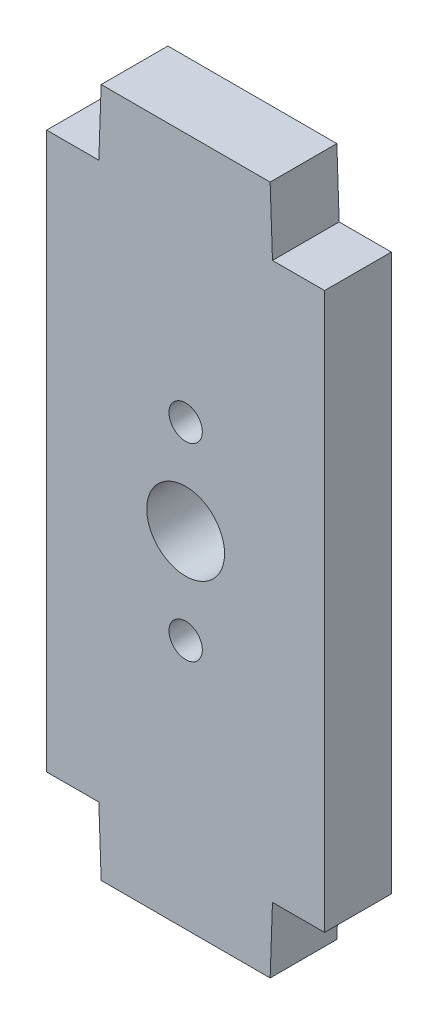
SolidWorks part; units mm, degrees
ref_plane "Front" through (0, 0, 0) normal (0, 0, 1) x (1, 0, 0)
ref_plane "Top" through (0, 0, 0) normal (0, 1, 0) x (1, 0, 0)
ref_plane "Right" through (0, 0, 0) normal (1, 0, 0) x (0, 0, -1)
sketch "Sketch1" plane through (0, 0, 0) normal (0, 0, 1) x (1, 0, 0)
  line L0 (12.5, 25) -> (-12.5, -25) construction
  line L1 (-12.5, -25) -> (12.5, -25)
  line L2 (-12.5, -25) -> (-12.5, 25)
  line L3 (-12.5, 25) -> (12.5, 25)
  line L4 (12.5, -25) -> (12.5, 25)
  dimension "D1" = 25
  dimension "D2" = 50
extrude "Boss-Extrude1" add sketch "Sketch1" along normal blind 6
sketch "Sketch2" plane through (0, 0, 6) normal (0, 0, 1) x (1, 0, 0)
  line L0 (-6.6136, 0) -> (6.6136, 0) construction
  circle A0 centre (0, 0) radius 3.5
  circle A1 centre (0, -8.5) radius 1.5
  circle A2 centre (0, 8.5) radius 1.5
  circle A4 centre (0, 0) radius 12.5 construction
  dimension "D2" = 3
  dimension "D3" = 7
  dimension "D4" = 25
  dimension "D1" = 17
extrude "motor hole pattern" cut sketch "Sketch2" against normal through all
sketch "Sketch3" plane through (0, 0, 6) normal (0, 0, 1) x (1, 0, 0)
  line L0 (-12.5, -25) -> (12.5, -25) construction
  line L1 (12.5, 25) -> (-12.5, 25) construction
  point P0 (-3.2061, 46.6368)
  line B0 (7.8095, -25) -> (-7.8095, -25)
  line B1 (-7.8095, -25) -> (-7.6, -31)
  line B2 (-7.6, -31) -> (7.6, -31)
  line B3 (7.8095, -25) -> (7.6, -31)
  line B4 (-7.8095, 25) -> (7.8095, 25)
  line B5 (7.8095, 25) -> (7.6, 31)
  line B6 (7.6, 31) -> (-7.6, 31)
  line B7 (-7.8095, 25) -> (-7.6, 31)
sketch_block_instance "Block-laser-cut-tab-15x6-1"
sketch_block "Block-laser-cut-tab-15x6" parameters "D1"=6, "D2"=15.2, "D3"=88
sketch_block_instance "Block-laser-cut-tab-15x6-2"
extrude "tabs" add sketch "Sketch3" against normal up to surface (6 mm away)
